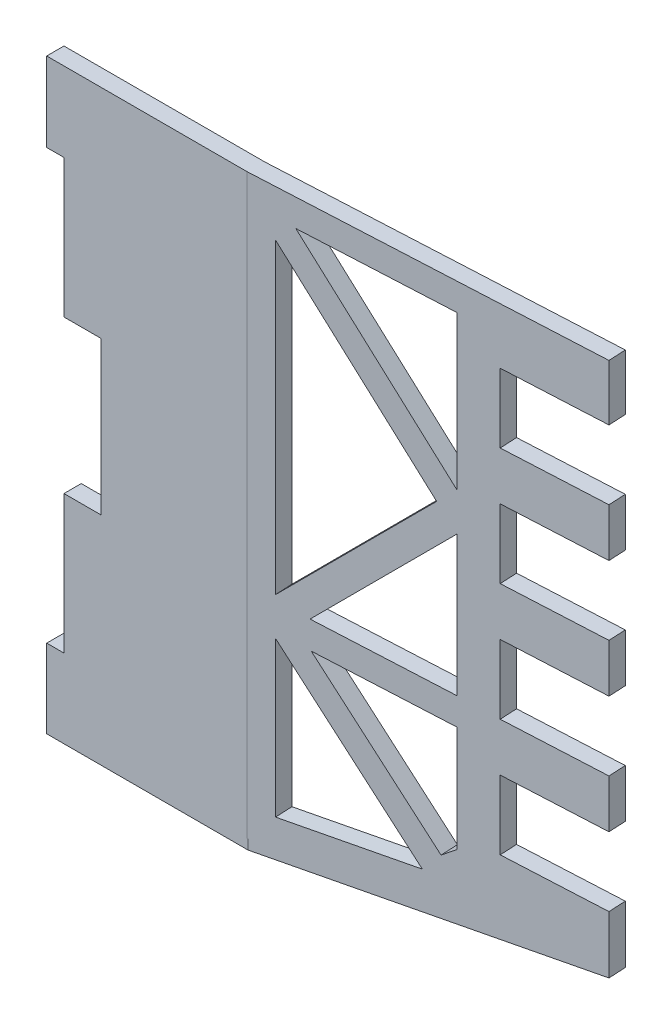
SolidWorks part; units mm, degrees
other "<TailRightWall_front>-<Boss-Extrude8>"
ref_plane "Front Plane" through (0, 0, 0) normal (0, 0, 1) x (1, 0, 0)
ref_plane "Top Plane" through (0, 0, 0) normal (0, 1, 0) x (1, 0, 0)
ref_plane "Right Plane" through (0, 0, 0) normal (1, 0, 0) x (0, 0, -1)
mirrored part "TailRightWall_front_Mirrored"
